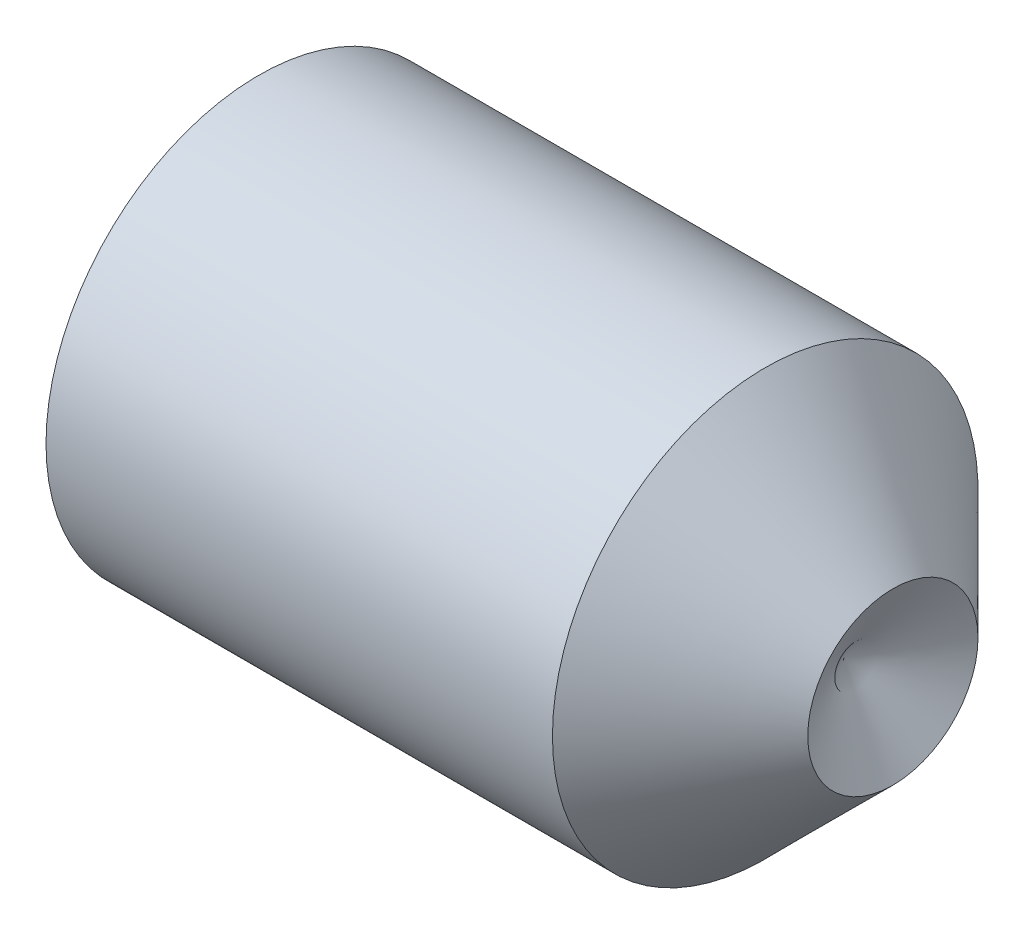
SolidWorks part; units mm, degrees
ref_plane "Plane1" through (0, 0, 0) normal (0, 0, 1) x (1, 0, 0)
ref_plane "Plane2" through (0, 0, 0) normal (0, 1, 0) x (1, 0, 0)
ref_plane "Plane3" through (0, 0, 0) normal (1, 0, 0) x (0, 0, -1)
revolve "BaseBody" add sketch "BodySke" angle 360 about L5
sketch "BodySke" plane through (0, 0, 0) normal (0, 0, 1) x (1, 0, 0)
  line L0 (0, 0) -> (0, 0.774)
  line L1 (0, 0.774) -> (0.2748, 1.25)
  line L2 (0.2748, 1.25) -> (3.25, 1.25)
  line L3 (3.25, 1.25) -> (4, 0.5)
  line L4 (3.7113, 0) -> (0, 0)
  line L5 (-12.7, 0) -> (88.9, 0) construction
  line L6 (3.7113, 0) -> (4, 0.5)
  line L7 (4, 0.5) -> (4, 10.025) construction
  line L8 (0, -0.774) -> (0.2748, -1.25) construction
  line L9 (3.7113, 0) -> (4, -0.5) construction
  line L10 (3.25, -1.25) -> (4, -0.5) construction
  line L11 (0.2, 15.875) -> (0.2, -3.175) construction
  dimension "Length" = 4
  dimension "Diameter" = 2.5
  dimension "Drive_ch_ang" = 60
  dimension "Minor_dia" = 1.548
  dimension "Cup_nose_ang" = 45
  dimension "Cup_ang" = 120
  dimension "Cup_dia" = 1
  dimension "Advance" = 0.4
sketch "Sketch2" plane through (0, 0, 0) normal (-1, 0, 0) x (0, 0, 1)
  line L0 (0.2598, 0.45) -> (-0.2598, 0.45)
  line L1 (-0.2598, 0.45) -> (-0.5196, 0)
  line L2 (0.2598, 0.45) -> (0.5196, 0)
  line L3 (0.2598, -0.45) -> (0.5196, 0)
  line L4 (0.2598, -0.45) -> (-0.2598, -0.45)
  line L5 (-0.2598, -0.45) -> (-0.5196, 0)
  dimension "Hex_size" = 0.9
  dimension "D2" = 0.45
  dimension "D3" = 0.45
extrude "Hex" cut sketch "Sketch2" against normal blind 1.7
sketch "ThdSchSke" plane through (0, 0, 0) normal (0, 0, 1) x (1, 0, 0)
  line L0 (0.2748, -0.774) -> (-0.0585, -1.25)
  line L1 (0.2748, -0.774) -> (0.6081, -1.25)
  line L2 (0.6081, -1.25) -> (0.6081, -1.5625)
  line L3 (-3.175, 0) -> (5.1513, 0) construction
  line L4 (0.2748, 1.25) -> (0.2748, -1.25) construction
  line L5 (0.6081, -1.5625) -> (-0.0585, -1.5625)
  line L6 (-0.0585, -1.5625) -> (-0.0585, -1.25)
  dimension "Thread_minor" = 1.548
  dimension "Diameter" = 2.5
  dimension "SideAngle" = 55
  dimension "VeeAngle" = 70
  dimension "Overcut" = 3.125
revolve "ThreadSchematic" cut sketch "ThdSchSke" angle 360 about L3
pattern_linear "ThdSchPat"
equation "\"D2@Sketch2\" = \"Hex_size@Sketch2\" / 2"
equation "\"D3@Sketch2\" = \"Hex_size@Sketch2\" / 2"
equation "\"Thread_minor@ThreadCosmetic\" = \"Minor_dia@BodySke\""
equation "\"Thread_minor@ThdSchSke\" = \"Thread_minor@ThreadCosmetic\""
equation "\"Diameter@ThdSchSke\" = \"Diameter@BodySke\""
equation "\"Overcut@ThdSchSke\" = \"Diameter@BodySke\" * 1.25"
equation "\"Num_threads@ThdSchPat\" = int( (\"Length@BodySke\" - ( ( ( \"Diameter@BodySke\" - \"Minor_dia@BodySke\" ) * 0.5 ) / tan( \"Drive_ch_ang@BodySke\" * 0.017453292 ) ) - ( ( ( \"Diameter@BodySke\" - \"Cup_dia@BodySk"
equation "\"Advance@ThdSchPat\" = (\"Length@BodySke\" - ( ( ( \"Diameter@BodySke\" - \"Minor_dia@BodySke\" ) * 0.5 ) / tan( \"Drive_ch_ang@BodySke\" * 0.017453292 ) ) - ( ( ( \"Diameter@BodySke\" - \"Cup_dia@BodySke\" ) * 0."
equation "' \"Num_threads@ThdSchPat\" = \"Num_threads@ThdSchPat\" - sgn( \"Num_threads@ThdSchPat\" - 1) '---chamfered tips only---"
